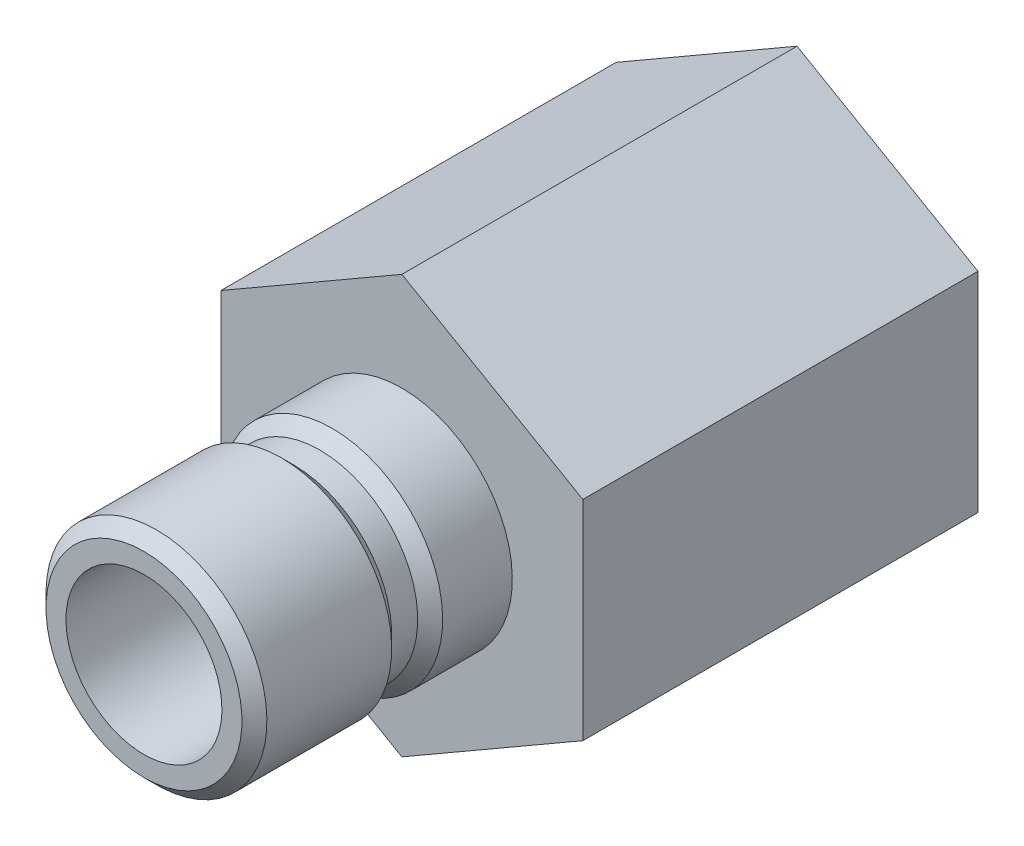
SolidWorks part; units mm, degrees
ref_plane "Front Plane" through (0, 0, 0) normal (0, 0, 1) x (1, 0, 0)
ref_plane "Top Plane" through (0, 0, 0) normal (0, 1, 0) x (1, 0, 0)
ref_plane "Right Plane" through (0, 0, 0) normal (1, 0, 0) x (0, 0, -1)
sketch "Sketch1" plane through (0, 0, 0) normal (1, 0, 0) x (0, 0, -1)
  line L0 (0, 0) -> (-18.923, 0) construction
  line L1 (-15.748, 4.7625) -> (-15.748, 5.9817)
  line L2 (-6.604, 5.9817) -> (-6.604, 0) construction
  line L3 (-14.986, 6.7437) -> (-7.366, 6.7437)
  line L4 (0, 13.2842) -> (0, 0) construction
  line L5 (-6.604, 5.9817) -> (-5.0165, 5.9817)
  line L6 (-4.2545, 6.7437) -> (0, 6.7437)
  line L7 (0, 6.7437) -> (0, 13.2842)
  line L8 (-6.604, 5.9817) -> (-7.366, 6.7437)
  line L9 (-5.0165, 5.9817) -> (-4.2545, 6.7437)
  line L10 (-15.748, 5.9817) -> (-14.986, 6.7437)
  line L11 (-15.748, 4.7625) -> (8.9789, 4.7625)
  line L12 (0, 13.2842) -> (24.13, 13.2842)
  line L13 (8.9789, 4.7625) -> (8.9789, 8.9281)
  line L14 (24.13, 13.2842) -> (24.13, 9.4016)
  line L15 (8.9789, 8.9281) -> (24.13, 9.4016)
  dimension "D1" = 15.748
  dimension "D2" = 1.5875
  dimension "D3" = 0.762
  dimension "D4" = 45
  dimension "D5" = 9.144
  dimension "D6" = 45
  dimension "D7" = 26.5684
  dimension "D8" = 9.525
  dimension "D9" = 39.878
  dimension "D10" = 3.175
  dimension "D11" = 17.8562
  dimension "D12" = 15.1511
  dimension "D13" = 1.79
  dimension "D14" = 13.4874
revolve "Revolve1" add sketch "Sketch1" angle 360 about L0
sketch "Sketch2" plane through (0, 0, 0) normal (0, 0, 1) x (1, 0, 0)
  line L1 (-11.049, 6.3791) -> (-11.049, -6.3791)
  line L2 (-11.049, -6.3791) -> (0, -12.7583)
  line L3 (0, -12.7583) -> (11.049, -6.3791)
  line L4 (11.049, -6.3791) -> (11.049, 6.3791)
  line L5 (11.049, 6.3791) -> (0, 12.7583)
  line L6 (0, 12.7583) -> (-11.049, 6.3791)
  circle A0 centre (0, 0) radius 11.049 construction
  dimension "D1" = 22.098
extrude "Cut-Extrude1" cut sketch "Sketch2" against normal through all flip side to cut
